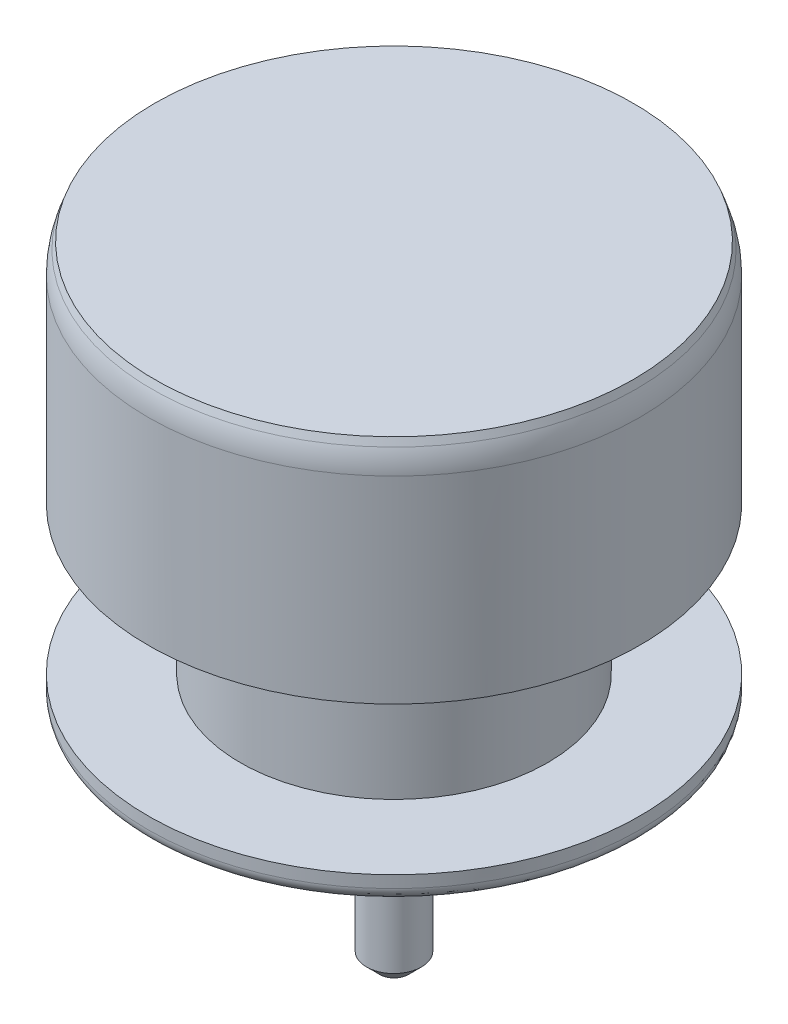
SolidWorks part; units mm, degrees
ref_plane "X_Y" through (0, 0, 0) normal (0, 0, 1) x (1, 0, 0)
ref_plane "Z_X" through (0, 0, 0) normal (0, 1, 0) x (1, 0, 0)
ref_plane "Y_Z" through (0, 0, 0) normal (1, 0, 0) x (0, 0, -1)
sketch "Sketch1" plane through (0, 0, 0) normal (0, 0, 1) x (1, 0, 0)
  line L0 (0, 0) -> (0, -9.6)
  line L2 (0.42, -7.9575) -> (3.76, -6.0292)
  line L3 (3.76, -6.0292) -> (3.76, -5.73)
  line L4 (3.76, -5.73) -> (2.35, -5.73)
  line L5 (2.35, -5.73) -> (2.35, -3.47)
  line L6 (2.35, -3.47) -> (3.76, -3.47)
  line L7 (3.76, -3.47) -> (3.76, -0.2747)
  line L8 (3.66, 0) -> (0, 0)
  line L10 (3.66, 0) -> (3.76, -0.2747)
  line L11 (0, -0.986) -> (0, -50000.986) construction
  line L12 (0.42, -7.9575) -> (0.42, -9.6)
  line L13 (0.42, -9.6) -> (0, -9.6)
  point P10 (0, -8.2)
  point P11 (2.35, -4.6)
  dimension "D1" = 6.0292
  dimension "D2" = 7.52
  dimension "D3" = 60
  dimension "D4" = 4.6
  dimension "D5" = 2.26
  dimension "D6" = 4.7
  dimension "D7" = 0.84
  dimension "D8" = 0.1
  dimension "D9" = 20
  dimension "D10" = 8.2
  dimension "D11" = 9.6
  dimension "D12" = 1.4
  dimension "D13" = 0.2992
revolve "Revolve1" add sketch "Sketch1" angle 360 about L0
fillet "Fillet1" radius 0.2 1 edges at (-3.76, -6.0292, 0)
fillet "Fillet2" radius 1 1 edges at (-3.76, -0.2747, 0)
chamfer "Chamfer1" distance 0.2 angle 45 1 edges at (-0.42, -9.6, 0)
